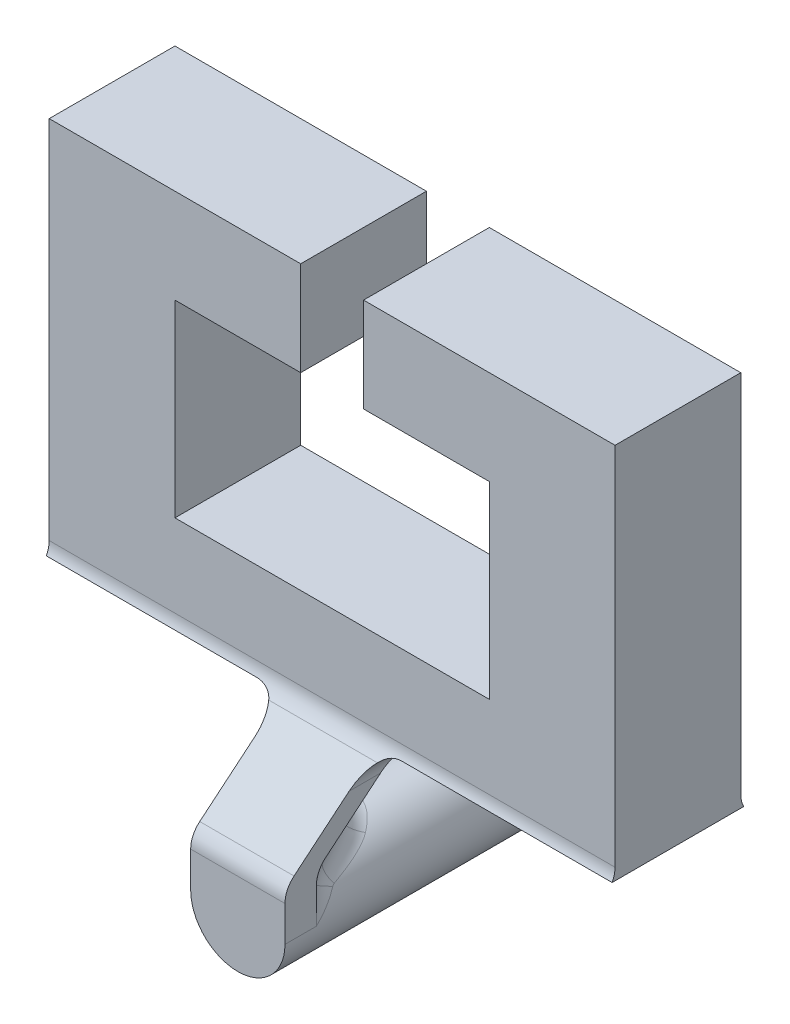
SolidWorks part; units mm, degrees
ref_plane "Front Plane" through (0, 0, 0) normal (0, 0, 1) x (1, 0, 0)
ref_plane "Top Plane" through (0, 0, 0) normal (0, 1, 0) x (1, 0, 0)
ref_plane "Right Plane" through (0, 0, 0) normal (1, 0, 0) x (0, 0, -1)
sketch "Sketch1" plane through (0, 0, 0) normal (0, 0, 1) x (1, 0, 0)
  line L0 (57.15, 0) -> (57.15, 76.2) construction
  line L1 (0, 0) -> (114.3, 0)
  line L2 (0, 0) -> (0, 76.2)
  line L3 (0, 76.2) -> (114.3, 76.2)
  line L4 (114.3, 0) -> (114.3, 76.2)
extrude "Boss-Extrude1" add sketch "Sketch1" along normal blind 25.4
sketch "Sketch4" plane through (0, 0, 25.4) normal (0, 0, 1) x (1, 0, 0)
  line L0 (63.5, 76.2) -> (50.8, 76.2)
  line L1 (0, 76.2) -> (114.3, 76.2) construction
  line L2 (50.8, 76.2) -> (50.8, 57.15)
  line L3 (50.8, 57.15) -> (25.4, 57.15)
  line L4 (25.4, 57.15) -> (25.4, 19.05)
  line L5 (25.4, 19.05) -> (88.9, 19.05)
  line L6 (88.9, 19.05) -> (88.9, 57.15)
  line L7 (88.9, 57.15) -> (63.5, 57.15)
  line L8 (63.5, 57.15) -> (63.5, 76.2)
  point P5 (57.15, 76.2)
extrude "Cut-Extrude1" cut sketch "Sketch4" against normal up to next
sketch3d "3DSketch2" plane through (0, 0, 0) normal (0, 0, 1) x (1, 0, 0)
  dimension "D1" = 12.7
sketch "Sketch5" plane through (0, 0, 12.7) normal (0, 0, 1) x (1, 0, 0)
  line L0 (53.975, 0) -> (60.325, 0)
  line L2 (0, 0) -> (114.3, 0) construction
  line L3 (60.325, 0) -> (60.325, -16.4197)
  line L4 (53.975, 0) -> (53.975, -16.4197)
  arc A1 (60.325, -16.4197) -> (53.975, -16.4197) centre (57.15, -25.4) ccw
  circle A2 centre (57.15, -25.4) radius 9.525
  point P4 (57.15, 0)
extrude "Boss-Extrude2" add sketch "Sketch5" along normal mid plane 63.5 separate body contours A2
ref_plane "Plane3" through (57.15, 0, 0) normal (-1, 0, 0) x (0, 0, 1)
sketch "Sketch6" plane through (57.15, 0, 0) normal (-1, 0, 0) x (0, 0, 1)
  line L0 (0, 0) -> (-19.05, -15.875)
  line L1 (25.4, 0) -> (44.45, -15.875)
  line L2 (-19.05, -15.875) -> (-12.7, -15.875)
  line L3 (44.45, -15.875) -> (-19.05, -15.875) construction
  line L4 (-12.7, -15.875) -> (6.35, 0)
  line L5 (25.4, 0) -> (0, 0) construction
  line L6 (44.45, -15.875) -> (38.1, -15.875)
  line L7 (38.1, -15.875) -> (19.05, 0)
  line L8 (6.35, 0) -> (0, 0)
  line L9 (19.05, 0) -> (25.4, 0)
extrude "Boss-Extrude3" add sketch "Sketch6" along normal mid plane 19.05
ref_plane "Plane4" through (47.625, -15.875, -19.05) normal (0, 0, 1) x (1, 0, 0)
sketch "Sketch13" plane through (0, -15.875, 0) normal (0, -1, 0) x (1, 0, 0)
  line L1 (47.625, 44.45) -> (66.675, 44.45)
  line L2 (47.625, 44.45) -> (47.625, 38.1)
  line L3 (47.625, 38.1) -> (66.675, 38.1)
  line L4 (66.675, 44.45) -> (66.675, 38.1)
  line L6 (66.675, 38.1) -> (66.675, 44.45) construction
  line L7 (66.675, -19.05) -> (66.675, 44.45) construction
  line L9 (66.675, -19.05) -> (47.625, -19.05)
  line L10 (66.675, -19.05) -> (66.675, -12.7)
  line L11 (66.675, -12.7) -> (47.625, -12.7)
  line L12 (47.625, -19.05) -> (47.625, -12.7)
  line L13 (47.625, 44.45) -> (47.625, -19.05) construction
extrude "Boss-Extrude4" add sketch "Sketch13" along normal blind 9.525
fillet "Fillet2" radius 5.08 14 edges at (57.15, 0, 19.05) (57.15, 0, 6.35) (47.625, 0, 3.175) (66.675, 0, 3.175) (66.675, 0, 22.225) (47.625, 0, 22.225) (61.9125, -15.875, 38.1) (61.9125, -15.875, -12.7) (57.15, -15.875, 44.45) (57.15, -15.875, -19.05) (52.3875, -15.875, 38.1) (52.3875, -15.875, -12.7) (57.15, 0, 25.4) (57.15, 0, 0)
fillet "Fillet4" radius 6.35 4 edges at (65.8309, -21.4797, -12.7) (65.8309, -21.4797, 38.1) (48.4691, -21.4797, -12.7) (48.4691, -21.4797, 38.1)
equation "\"D4@Sketch13\"=\"A\""
equation "\"D3@Sketch13\"=\"B\""
equation "\"D2@Sketch13\"=\"A\""
equation "\"D1@Sketch13\"=\"B\""
equation "\"D2@Sketch6\"=\"B\""
equation "\"D1@Sketch6\"=\"B\""
equation "\"D1@Sketch1\"=\"BodyHeight\""
equation "\"A\"= .750in"
equation "\"B\"= .250in"
equation "\"C\"= .750in"
equation "\"D\"= 1in"
equation "\"E\"=0.75"
equation "\"OW\"= 4.5in"
equation "\"PL\"= 2.50in"
equation "\"Slot\"= 0.5in"
equation "\"PocketWidth\"= 2.5in"
equation "\"PocketHeight\"= 1.5in"
equation "\"BodyHeight\"= \"C\" + \"PocketHeight\" + \"E\""
equation "\"ConnectorDepth\"= 0.5in"
equation "\"PinDrop\"= 1in"
equation "\"D2@Sketch1\"=\"OW\""
equation "\"D1@Boss-Extrude1\"=\"D\""
equation "\"D1@Sketch4\"=\"A\""
equation "\"D2@Sketch4\"=\"PL\""
equation "\"D3@Sketch4\"=\"PocketHeight\""
equation "\"D1@Sketch5\"=\"B\""
equation "\"D2@Sketch5\"=\"PinDrop\""
equation "\"D3@Sketch5\"=\"A\""
equation "\"D1@Boss-Extrude3\"=\"A\""
equation "\"D1@Boss-Extrude2\"=\"Slot\""
